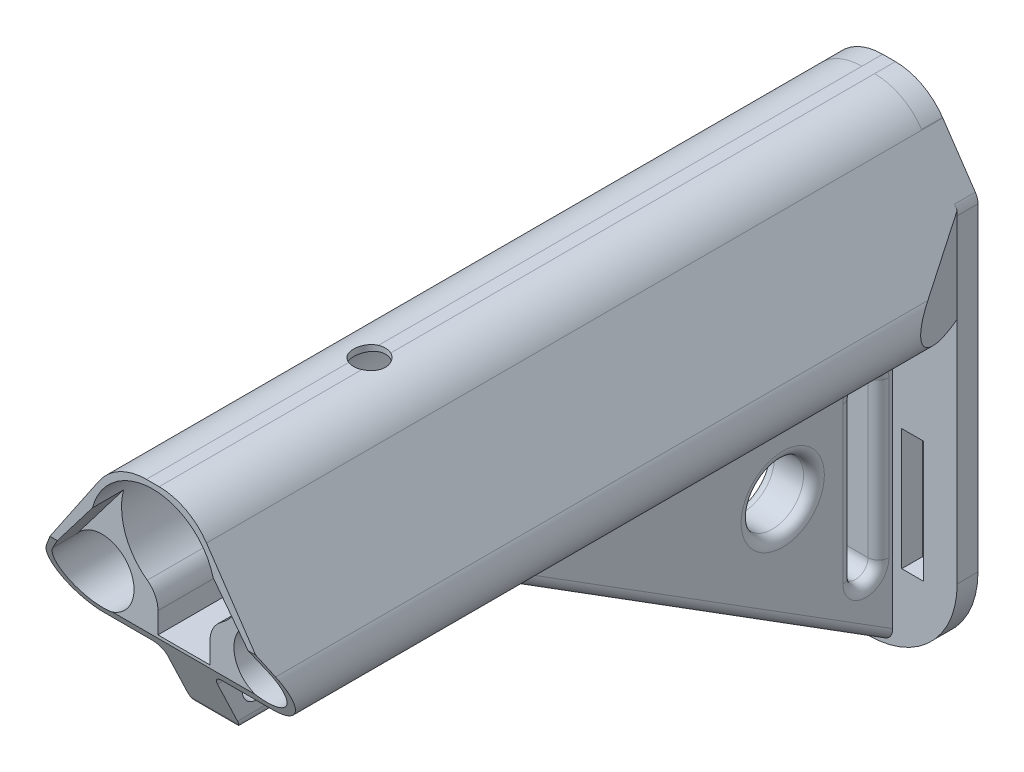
SolidWorks part; units mm, degrees
ref_plane "Front Plane" through (0, 0, 0) normal (0, 0, 1) x (1, 0, 0)
ref_plane "Top Plane" through (0, 0, 0) normal (0, 1, 0) x (1, 0, 0)
ref_plane "Right Plane" through (0, 0, 0) normal (1, 0, 0) x (0, 0, -1)
imported_body "Imported1"
imported_body "Imported2"
imported_body "Imported3"
sketch "Sketch2" plane through (0, -15.3594, 0) normal (0, -1, 0) x (1, 0, 0)
  circle A0 centre (-0.127, 121.6089) radius 3.8989
extrude "Cut-Extrude1" cut sketch "Sketch2" against normal blind 67.818
sketch "Sketch3" plane through (0, 0, -3.81) normal (0, 0, -1) x (-1, 0, 0)
  line L0 (21.717, 12.8644) -> (21.717, 14.3622) construction
  line L1 (21.717, 14.3622) -> (-21.717, 14.3622) construction
  line L2 (-21.717, 14.3622) -> (-21.717, 12.8644) construction
  line L3 (-21.717, 12.8644) -> (21.717, 12.8644) construction
  line L4 (21.717, 10.3244) -> (21.717, 11.8222) construction
  line L5 (21.717, 11.8222) -> (-21.717, 11.8222) construction
  line L6 (-21.717, 11.8222) -> (-21.717, 10.3244) construction
  line L7 (-21.717, 10.3244) -> (21.717, 10.3244) construction
  line L8 (21.717, 7.7844) -> (21.717, 9.2822) construction
  line L9 (21.717, 9.2822) -> (-21.717, 9.2822) construction
  line L10 (-21.717, 9.2822) -> (-21.717, 7.7844) construction
  line L11 (-21.717, 7.7844) -> (21.717, 7.7844) construction
  line L12 (-15.1656, 5.2444) -> (15.1656, 5.2444) construction
  line L13 (15.1656, 6.7422) -> (-15.1656, 6.7422) construction
  line L14 (-21.717, 6.7422) -> (-21.717, 5.2444) construction
  line L15 (-21.717, 5.2444) -> (-18.1084, 5.2444) construction
  line L16 (-18.1084, 6.7422) -> (-21.717, 6.7422) construction
  line L17 (21.717, 5.2444) -> (21.717, 6.7422) construction
  line L18 (21.717, 6.7422) -> (18.1084, 6.7422) construction
  line L19 (18.1084, 5.2444) -> (21.717, 5.2444) construction
  line L20 (21.717, 2.7044) -> (21.717, 4.2022) construction
  line L21 (21.717, 4.2022) -> (-21.717, 4.2022) construction
  line L22 (-21.717, 4.2022) -> (-21.717, 2.7044) construction
  line L23 (-21.717, 2.7044) -> (21.717, 2.7044) construction
  line L24 (21.717, 0.1644) -> (21.717, 1.6622) construction
  line L25 (21.717, 1.6622) -> (3.6437, 1.6622) construction
  line L26 (3.6437, 1.6622) -> (3.6437, 0.1644) construction
  line L27 (3.6437, 0.1644) -> (21.717, 0.1644) construction
  line L28 (-21.717, 1.6622) -> (-21.717, 0.1644) construction
  line L29 (-21.717, 0.1644) -> (-3.6437, 0.1644) construction
  line L30 (-3.6437, 0.1644) -> (-3.6437, 1.6622) construction
  line L31 (-3.6437, 1.6622) -> (-21.717, 1.6622) construction
  line L32 (21.717, -2.3756) -> (21.717, -0.8778) construction
  line L33 (21.717, -0.8778) -> (-21.717, -0.8778) construction
  line L34 (-21.717, -0.8778) -> (-21.717, -2.3756) construction
  line L35 (-21.717, -2.3756) -> (21.717, -2.3756) construction
  line L36 (21.717, -4.9156) -> (21.717, -3.4178) construction
  line L37 (21.717, -3.4178) -> (-21.717, -3.4178) construction
  line L38 (-21.717, -3.4178) -> (-21.717, -4.9156) construction
  line L39 (-21.717, -4.9156) -> (21.717, -4.9156) construction
  line L40 (21.717, -7.4556) -> (21.717, -5.9578) construction
  line L41 (21.717, -5.9578) -> (-21.717, -5.9578) construction
  line L42 (-21.717, -5.9578) -> (-21.717, -7.4556) construction
  line L43 (-21.717, -7.4556) -> (21.717, -7.4556) construction
  line L44 (21.717, -9.9956) -> (21.717, -8.4978) construction
  line L45 (21.717, -8.4978) -> (-21.717, -8.4978) construction
  line L46 (-21.717, -8.4978) -> (-21.717, -9.9956) construction
  line L47 (-21.717, -9.9956) -> (21.717, -9.9956) construction
  line L48 (21.717, -12.5356) -> (21.717, -11.0378) construction
  line L49 (21.717, -11.0378) -> (-21.717, -11.0378) construction
  line L50 (-21.717, -11.0378) -> (-21.717, -12.5356) construction
  line L51 (-21.717, -12.5356) -> (21.717, -12.5356) construction
  line L52 (21.717, -15.0756) -> (21.717, -13.5778) construction
  line L53 (21.717, -13.5778) -> (-21.717, -13.5778) construction
  line L54 (-21.717, -13.5778) -> (-21.717, -15.0756) construction
  line L55 (-21.717, -15.0756) -> (21.717, -15.0756) construction
  line L56 (21.717, -17.6156) -> (21.717, -16.1178) construction
  line L57 (21.717, -16.1178) -> (-21.717, -16.1178) construction
  line L58 (-21.717, -16.1178) -> (-21.717, -17.6156) construction
  line L59 (-21.717, -17.6156) -> (21.717, -17.6156) construction
  line L60 (21.717, -20.1556) -> (21.717, -18.6578) construction
  line L61 (21.717, -18.6578) -> (-21.717, -18.6578) construction
  line L62 (-21.717, -18.6578) -> (-21.717, -20.1556) construction
  line L63 (-21.717, -20.1556) -> (21.717, -20.1556) construction
  line L64 (21.717, -22.6956) -> (21.717, -21.1978) construction
  line L65 (21.717, -21.1978) -> (-21.717, -21.1978) construction
  line L66 (-21.717, -21.1978) -> (-21.717, -22.6956) construction
  line L67 (-21.717, -22.6956) -> (21.717, -22.6956) construction
  line L68 (21.717, -25.2356) -> (21.717, -23.7378) construction
  line L69 (21.717, -23.7378) -> (-21.717, -23.7378) construction
  line L70 (-21.717, -23.7378) -> (-21.717, -25.2356) construction
  line L71 (-21.717, -25.2356) -> (21.717, -25.2356) construction
  line L72 (21.717, -27.7756) -> (21.717, -26.2778) construction
  line L73 (21.717, -26.2778) -> (-21.717, -26.2778) construction
  line L74 (-21.717, -26.2778) -> (-21.717, -27.7756) construction
  line L75 (-21.717, -27.7756) -> (21.717, -27.7756) construction
  line L76 (21.717, 12.8644) -> (21.717, 14.3622)
  line L77 (21.717, 14.3622) -> (-21.717, 14.3622)
  line L78 (-21.717, 14.3622) -> (-21.717, 12.8644)
  line L79 (-21.717, 12.8644) -> (21.717, 12.8644)
  line L80 (21.717, 10.3244) -> (21.717, 11.8222)
  line L81 (21.717, 11.8222) -> (-21.717, 11.8222)
  line L82 (-21.717, 11.8222) -> (-21.717, 10.3244)
  line L83 (-21.717, 10.3244) -> (21.717, 10.3244)
  line L84 (21.717, 7.7844) -> (21.717, 9.2822)
  line L85 (21.717, 9.2822) -> (-21.717, 9.2822)
  line L86 (-21.717, 9.2822) -> (-21.717, 7.7844)
  line L87 (-21.717, 7.7844) -> (21.717, 7.7844)
  line L88 (-15.1656, 5.2444) -> (15.1656, 5.2444)
  line L89 (15.1656, 6.7422) -> (-15.1656, 6.7422)
  line L90 (-21.717, 6.7422) -> (-21.717, 5.2444)
  line L91 (-21.717, 5.2444) -> (-18.1084, 5.2444)
  line L92 (-18.1084, 6.7422) -> (-21.717, 6.7422)
  line L93 (21.717, 5.2444) -> (21.717, 6.7422)
  line L94 (21.717, 6.7422) -> (18.1084, 6.7422)
  line L95 (18.1084, 5.2444) -> (21.717, 5.2444)
  line L96 (21.717, 2.7044) -> (21.717, 4.2022)
  line L97 (21.717, 4.2022) -> (-21.717, 4.2022)
  line L98 (-21.717, 4.2022) -> (-21.717, 2.7044)
  line L99 (-21.717, 2.7044) -> (21.717, 2.7044)
  line L100 (21.717, 0.1644) -> (21.717, 1.6622)
  line L101 (21.717, 1.6622) -> (3.6437, 1.6622)
  line L102 (3.6437, 1.6622) -> (3.6437, 0.1644)
  line L103 (3.6437, 0.1644) -> (21.717, 0.1644)
  line L104 (-21.717, 1.6622) -> (-21.717, 0.1644)
  line L105 (-21.717, 0.1644) -> (-3.6437, 0.1644)
  line L106 (-3.6437, 0.1644) -> (-3.6437, 1.6622)
  line L107 (-3.6437, 1.6622) -> (-21.717, 1.6622)
  line L108 (21.717, -2.3756) -> (21.717, -0.8778)
  line L109 (21.717, -0.8778) -> (-21.717, -0.8778)
  line L110 (-21.717, -0.8778) -> (-21.717, -2.3756)
  line L111 (-21.717, -2.3756) -> (21.717, -2.3756)
  line L112 (21.717, -4.9156) -> (21.717, -3.4178)
  line L113 (21.717, -3.4178) -> (-21.717, -3.4178)
  line L114 (-21.717, -3.4178) -> (-21.717, -4.9156)
  line L115 (-21.717, -4.9156) -> (21.717, -4.9156)
  line L116 (21.717, -7.4556) -> (21.717, -5.9578)
  line L117 (21.717, -5.9578) -> (-21.717, -5.9578)
  line L118 (-21.717, -5.9578) -> (-21.717, -7.4556)
  line L119 (-21.717, -7.4556) -> (21.717, -7.4556)
  line L120 (21.717, -9.9956) -> (21.717, -8.4978)
  line L121 (21.717, -8.4978) -> (-21.717, -8.4978)
  line L122 (-21.717, -8.4978) -> (-21.717, -9.9956)
  line L123 (-21.717, -9.9956) -> (21.717, -9.9956)
  line L124 (21.717, -12.5356) -> (21.717, -11.0378)
  line L125 (21.717, -11.0378) -> (-21.717, -11.0378)
  line L126 (-21.717, -11.0378) -> (-21.717, -12.5356)
  line L127 (-21.717, -12.5356) -> (21.717, -12.5356)
  line L128 (21.717, -15.0756) -> (21.717, -13.5778)
  line L129 (21.717, -13.5778) -> (-21.717, -13.5778)
  line L130 (-21.717, -13.5778) -> (-21.717, -15.0756)
  line L131 (-21.717, -15.0756) -> (21.717, -15.0756)
  line L132 (21.717, -17.6156) -> (21.717, -16.1178)
  line L133 (21.717, -16.1178) -> (-21.717, -16.1178)
  line L134 (-21.717, -16.1178) -> (-21.717, -17.6156)
  line L135 (-21.717, -17.6156) -> (21.717, -17.6156)
  line L136 (21.717, -20.1556) -> (21.717, -18.6578)
  line L137 (21.717, -18.6578) -> (-21.717, -18.6578)
  line L138 (-21.717, -18.6578) -> (-21.717, -20.1556)
  line L139 (-21.717, -20.1556) -> (21.717, -20.1556)
  line L140 (21.717, -22.6956) -> (21.717, -21.1978)
  line L141 (21.717, -21.1978) -> (-21.717, -21.1978)
  line L142 (-21.717, -21.1978) -> (-21.717, -22.6956)
  line L143 (-21.717, -22.6956) -> (21.717, -22.6956)
  line L144 (21.717, -25.2356) -> (21.717, -23.7378)
  line L145 (21.717, -23.7378) -> (-21.717, -23.7378)
  line L146 (-21.717, -23.7378) -> (-21.717, -25.2356)
  line L147 (-21.717, -25.2356) -> (21.717, -25.2356)
  line L148 (21.717, -27.7756) -> (21.717, -26.2778)
  line L149 (21.717, -26.2778) -> (-21.717, -26.2778)
  line L150 (-21.717, -26.2778) -> (-21.717, -27.7756)
  line L151 (-21.717, -27.7756) -> (21.717, -27.7756)
  arc A0 (-15.1656, 5.2444) -> (-15.1656, 6.7422) centre (-16.637, 5.9933) ccw construction
  arc A1 (15.1656, 6.7422) -> (15.1656, 5.2444) centre (16.637, 5.9933) ccw construction
  arc A2 (-18.1084, 6.7422) -> (-18.1084, 5.2444) centre (-16.637, 5.9933) ccw construction
  arc A3 (18.1084, 5.2444) -> (18.1084, 6.7422) centre (16.637, 5.9933) ccw construction
  arc A4 (-15.1656, 5.2444) -> (-15.1656, 6.7422) centre (-16.637, 5.9933) ccw
  arc A5 (15.1656, 6.7422) -> (15.1656, 5.2444) centre (16.637, 5.9933) ccw
  arc A6 (-18.1084, 6.7422) -> (-18.1084, 5.2444) centre (-16.637, 5.9933) ccw
  arc A7 (18.1084, 5.2444) -> (18.1084, 6.7422) centre (16.637, 5.9933) ccw
extrude "Boss-Extrude1" add sketch "Sketch3" along normal up to surface (1.27 mm away)
sketch "Sketch4" plane through (2.667, 0, 0) normal (1, 0, 0) x (0, 0, -1)
  line L0 (-61.7658, -4.6006) -> (-16.0458, -4.6006) construction
  line L1 (-16.0458, -10.8388) -> (-61.7658, -10.8388) construction
  line L2 (-61.7658, -4.6006) -> (-16.0458, -4.6006)
  line L3 (-16.0458, -10.8388) -> (-61.7658, -10.8388)
  line L7 (-79.8508, -22.9642) -> (-40.9975, -47.6314)
  line L8 (-40.9975, -47.6314) -> (-33.8465, -39.0453)
  line L9 (-21.5799, -24.3169) -> (-1.3271, 0.0002)
  line L10 (-1.3271, 0.0002) -> (-114.6004, 0.0142)
  line L11 (-114.6004, 0.0142) -> (-114.6004, -12.8194)
  line L12 (-114.6004, -12.8194) -> (-96.7621, -12.8194)
  line L13 (-96.7621, -12.8194) -> (-79.8508, -22.9642)
  line L14 (-79.8508, -22.9642) -> (-40.9975, -47.6314)
  line L15 (-40.9975, -47.6314) -> (-33.8465, -39.0453)
  line L16 (-21.5799, -24.3169) -> (-1.3271, 0.0002)
  line L17 (-1.3271, 0.0002) -> (-114.6004, 0.0142)
  line L18 (-114.6004, 0.0142) -> (-114.6004, -12.8194)
  line L19 (-114.6004, -12.8194) -> (-96.7621, -12.8194)
  line L20 (-96.7621, -12.8194) -> (-79.8508, -22.9642)
  arc A0 (-61.7658, -4.6006) -> (-61.7658, -10.8388) centre (-61.7658, -7.7197) ccw construction
  arc A1 (-21.5799, -24.3169) -> (-33.8465, -39.0453) centre (-26.833, -32.4142) ccw
  arc A2 (-21.5799, -24.3169) -> (-33.8465, -39.0453) centre (-26.833, -32.4142) ccw
  arc A3 (-16.0458, -10.8388) -> (-16.0458, -4.6006) centre (-16.0458, -7.7197) ccw construction
  arc A4 (-61.7658, -4.6006) -> (-61.7658, -10.8388) centre (-61.7658, -7.7197) ccw
  arc A5 (-16.0458, -10.8388) -> (-16.0458, -4.6006) centre (-16.0458, -7.7197) ccw
  dimension "D1" = 0
extrude "Boss-Extrude4" add sketch "Sketch4" along normal up to surface and the other way up to surface
sketch "Sketch5" plane through (-2.667, 0, 0) normal (-1, 0, 0) x (0, 0, 1)
  line L0 (3.4591, -57.7399) -> (3.4591, -19.6879) construction
  line L1 (3.4591, -57.7399) -> (3.4591, -19.6879)
  line L2 (9.6065, -19.6879) -> (9.6065, -57.7399) construction
  line L3 (9.6065, -19.6879) -> (9.6065, -57.7399)
  line L4 (0, -73.66) -> (38.8532, -48.9928)
  line L5 (38.8532, -48.9928) -> (31.9955, -40.5696)
  line L6 (19.8939, -25.7053) -> (0, -1.27)
  line L7 (0, -1.27) -> (0, -73.66)
  line L8 (0, -73.66) -> (38.8532, -48.9928)
  line L9 (38.8532, -48.9928) -> (31.9955, -40.5696)
  line L10 (19.8939, -25.7053) -> (0, -1.27)
  line L11 (0, -1.27) -> (0, -73.66)
  arc A0 (9.6065, -19.6879) -> (3.4591, -19.6879) centre (6.5328, -19.6879) ccw construction
  arc A1 (19.8939, -25.7053) -> (31.9955, -40.5696) centre (26.833, -32.4142) ccw
  arc A2 (19.8939, -25.7053) -> (31.9955, -40.5696) centre (26.833, -32.4142) ccw
  arc A3 (3.4591, -57.7399) -> (9.6065, -57.7399) centre (6.5328, -57.7399) ccw construction
  arc A4 (9.6065, -19.6879) -> (3.4591, -19.6879) centre (6.5328, -19.6879) ccw
  arc A5 (3.4591, -57.7399) -> (9.6065, -57.7399) centre (6.5328, -57.7399) ccw
  dimension "D1" = 0
extrude "Boss-Extrude5" add sketch "Sketch5" along normal up to surface and the other way up to surface
sketch "Sketch6" plane through (0, 0, -3.81) normal (0, 0, -1) x (-1, 0, 0)
  line L0 (21.1998, -60.5914) -> (-21.1998, -60.5914) construction
  line L1 (-20.8887, -61.8204) -> (20.8887, -61.8204) construction
  line L2 (20.3788, -63.3854) -> (-20.3788, -63.3854) construction
  line L3 (-19.8831, -64.6144) -> (19.8831, -64.6144) construction
  line L4 (19.1193, -66.1794) -> (-19.1193, -66.1794) construction
  line L5 (-18.4045, -67.4084) -> (18.4045, -67.4084) construction
  line L6 (21.1998, -60.5914) -> (-21.1998, -60.5914)
  line L7 (-20.8887, -61.8204) -> (20.8887, -61.8204)
  line L8 (20.3788, -63.3854) -> (-20.3788, -63.3854)
  line L9 (-19.8831, -64.6144) -> (19.8831, -64.6144)
  line L10 (19.1193, -66.1794) -> (-19.1193, -66.1794)
  line L11 (-18.4045, -67.4084) -> (18.4045, -67.4084)
  arc A0 (20.8887, -61.8204) -> (21.1998, -60.5914) centre (0, -55.88) ccw construction
  arc A1 (-21.1998, -60.5914) -> (-20.8887, -61.8204) centre (0, -55.88) ccw construction
  arc A2 (19.8831, -64.6144) -> (20.3788, -63.3854) centre (0, -55.88) ccw construction
  arc A3 (-20.3788, -63.3854) -> (-19.8831, -64.6144) centre (0, -55.88) ccw construction
  arc A4 (18.4045, -67.4084) -> (19.1193, -66.1794) centre (0, -55.88) ccw construction
  arc A5 (-19.1193, -66.1794) -> (-18.4045, -67.4084) centre (0, -55.88) ccw construction
  arc A6 (20.8887, -61.8204) -> (21.1998, -60.5914) centre (0, -55.88) ccw
  arc A7 (-21.1998, -60.5914) -> (-20.8887, -61.8204) centre (0, -55.88) ccw
  arc A8 (19.8831, -64.6144) -> (20.3788, -63.3854) centre (0, -55.88) ccw
  arc A9 (-20.3788, -63.3854) -> (-19.8831, -64.6144) centre (0, -55.88) ccw
  arc A10 (18.4045, -67.4084) -> (19.1193, -66.1794) centre (0, -55.88) ccw
  arc A11 (-19.1193, -66.1794) -> (-18.4045, -67.4084) centre (0, -55.88) ccw
extrude "Boss-Extrude6" add sketch "Sketch6" along normal up to surface (1.27 mm away)
sketch "Sketch7" plane through (0, -0.1194, 0) normal (0, -1, 0) x (1, 0, 0)
  line L0 (8.763, 147.5806) -> (5.969, 147.5806) construction
  line L1 (5.969, 147.5806) -> (5.969, 132.0031) construction
  line L2 (5.969, 132.0031) -> (8.763, 132.0031) construction
  line L3 (8.763, 132.0031) -> (8.763, 147.5806) construction
  line L4 (-6.223, 132.0031) -> (-6.223, 147.5806) construction
  line L5 (-6.223, 147.5806) -> (-9.017, 147.5806) construction
  line L6 (-9.017, 147.5806) -> (-9.017, 132.0031) construction
  line L7 (-9.017, 132.0031) -> (-6.223, 132.0031) construction
  line L8 (8.763, 147.5806) -> (5.969, 147.5806)
  line L9 (5.969, 147.5806) -> (5.969, 132.0031)
  line L10 (5.969, 132.0031) -> (8.763, 132.0031)
  line L11 (8.763, 132.0031) -> (8.763, 147.5806)
  line L12 (-6.223, 132.0031) -> (-6.223, 147.5806)
  line L13 (-6.223, 147.5806) -> (-9.017, 147.5806)
  line L14 (-9.017, 147.5806) -> (-9.017, 132.0031)
  line L15 (-9.017, 132.0031) -> (-6.223, 132.0031)
extrude "Cut-Extrude2" cut sketch "Sketch7" against normal up to surface (0.1357 mm away)
sketch "Sketch9" plane through (0, 2.6545, 0) normal (0, -1, 0) x (1, 0, 0)
  line L4 (-4.2631, 167.005) -> (-4.2631, 159.385)
  line L5 (-4.2631, 159.385) -> (4.2631, 159.385)
  line L6 (4.2631, 159.385) -> (4.2631, 167.005)
  line L7 (4.2631, 167.005) -> (-4.2631, 167.005)
  line L8 (-4.2631, 167.005) -> (-4.2631, 159.385)
  line L9 (-4.2631, 159.385) -> (4.2631, 159.385)
  line L10 (4.2631, 159.385) -> (4.2631, 167.005)
  line L11 (4.2631, 167.005) -> (-4.2631, 167.005)
  dimension "D1" = 0
extrude "Cut-Extrude3" cut sketch "Sketch9" against normal blind 8.763
sketch "Sketch10" plane through (0, 0, 159.385) normal (0, 0, 1) x (1, 0, 0)
  line L4 (4.2631, -12.9339) -> (4.2631, 2.8152)
  line L5 (4.2631, 2.8152) -> (-4.2631, 2.8152)
  line L6 (-4.2631, 2.8152) -> (-4.2631, -12.9339)
  line L7 (-4.2631, -12.9339) -> (4.2631, -12.9339)
  line L8 (4.2631, -12.9339) -> (4.2631, 2.8152)
  line L9 (4.2631, 2.8152) -> (-4.2631, 2.8152)
  line L10 (-4.2631, 2.8152) -> (-4.2631, -12.9339)
  line L11 (-4.2631, -12.9339) -> (4.2631, -12.9339)
  dimension "D1" = 0
extrude "Boss-Extrude7" add sketch "Sketch10" along normal up to surface (7.9625 mm away)
sketch "Sketch11" plane through (-4.2631, 0, 0) normal (-1, 0, 0) x (0, 0, 1)
  line L3 (167.005, 2.8152) -> (167.005, 2.096)
  line L4 (167.005, 2.096) -> (167.3475, 2.8152)
  line L5 (167.3475, 2.8152) -> (167.005, 2.8152)
  line L6 (167.005, 2.8152) -> (167.005, 2.096)
  line L7 (167.005, 2.096) -> (167.3475, 2.8152)
  line L8 (167.3475, 2.8152) -> (167.005, 2.8152)
  dimension "D1" = 0
extrude "Cut-Extrude4" cut sketch "Sketch11" against normal blind 8.763
sketch "Sketch12" plane through (-6.223, 0, 0) normal (-1, 0, 0) x (0, 0, 1)
  line L1 (147.5806, -15.3594) -> (96.7621, -15.3594) construction
  line L3 (114.7114, -13.4544) -> (128.6953, -13.4544)
  line L4 (114.7114, -13.4544) -> (114.7114, -15.3594)
  line L5 (114.7114, -15.3594) -> (128.6953, -15.3594)
  line L6 (128.6953, -13.4544) -> (128.6953, -15.3594)
extrude "Boss-Extrude8" add sketch "Sketch12" against normal up to surface (12.192 mm away)
sketch "Sketch13" plane through (0, -13.4544, 0) normal (0, 1, 0) x (1, 0, 0)
  circle A0 centre (-0.127, -121.6089) radius 2.6035
extrude "Cut-Extrude5" cut sketch "Sketch13" against normal blind 8.763
fillet "Fillet15" radius 2.54 8 edges at (-6.223, -38.7139, 3.4591) (-6.223, -16.6142, 6.5328) (-6.223, -38.7139, 9.6065) (-6.223, -60.8136, 6.5328) (5.969, -38.7139, 3.4591) (5.969, -60.8136, 6.5328) (5.969, -38.7139, 9.6065) (5.969, -16.6142, 6.5328)
sketch "Sketch14" plane through (0, 0, 147.5806) normal (0, 0, -1) x (-1, 0, 0)
  line L0 (6.223, -15.3594) -> (11.557, -15.3594) construction
  line L1 (11.557, -15.3594) -> (11.557, 0.0101) construction
  line L2 (11.557, 0.0101) -> (9.017, 0.0101) construction
  line L3 (9.017, 0.0101) -> (9.017, 0.0182) construction
  line L4 (9.017, 0.0182) -> (6.223, 0.0182) construction
  line L5 (6.223, 0.0182) -> (6.223, -15.3594) construction
  line L6 (-8.763, 0.0182) -> (-8.763, 0.0101) construction
  line L7 (-8.763, 0.0101) -> (-11.303, 0.0101) construction
  line L8 (-11.303, 0.0101) -> (-11.303, -15.3594) construction
  line L9 (-11.303, -15.3594) -> (-5.969, -15.3594) construction
  line L10 (-5.969, -15.3594) -> (-5.969, 0.0182) construction
  line L11 (-5.969, 0.0182) -> (-8.763, 0.0182) construction
  line L12 (6.223, -15.3594) -> (11.557, -15.3594)
  line L13 (11.557, -15.3594) -> (11.557, 0.0101)
  line L14 (11.557, 0.0101) -> (9.017, 0.0101)
  line L15 (9.017, 0.0101) -> (9.017, 0.0182)
  line L16 (9.017, 0.0182) -> (6.223, 0.0182)
  line L17 (6.223, 0.0182) -> (6.223, -15.3594)
  line L18 (-8.763, 0.0182) -> (-8.763, 0.0101)
  line L19 (-8.763, 0.0101) -> (-11.303, 0.0101)
  line L20 (-11.303, 0.0101) -> (-11.303, -15.3594)
  line L21 (-11.303, -15.3594) -> (-5.969, -15.3594)
  line L22 (-5.969, -15.3594) -> (-5.969, 0.0182)
  line L23 (-5.969, 0.0182) -> (-8.763, 0.0182)
extrude "Cut-Extrude6" cut sketch "Sketch14" against normal blind 32.639
fillet "Fillet16" radius 2.54 10 edges at (-6.223, -32.4142, 34.453) (5.969, -32.4142, 34.453) (5.969, -4.6006, 38.9058) (5.969, -7.7197, 12.9267) (5.969, -10.8388, 38.9058) (5.969, -7.7197, 64.8849) (-6.223, -4.6006, 38.9058) (-6.223, -7.7197, 64.8849) (-6.223, -10.8388, 38.9058) (-6.223, -7.7197, 12.9267)
fillet "Fillet17" radius 2.54 5 edges at (-6.223, -15.3594, 127.7275) (5.969, -15.3594, 127.7275) (-6.223, -45.7797, 48.3811) (5.969, -45.7797, 48.3811) (-0.127, -15.3594, 158.6929)
fillet "Fillet18" radius 6.35 1 edges at (-6.4479, 11.5912, 83.5025)
fillet "Fillet19" radius 6.35 1 edges at (6.4479, 11.5912, 83.5025)
sketch "Sketch16" plane through (0, 0, 174.625) normal (0, 0, 1) x (1, 0, 0)
  line L0 (17.6986, 25.4) -> (12.9265, 31.6503)
  line L2 (-17.8809, 25.1604) -> (-13.837, 30.4565)
  line L3 (-13.837, 30.4565) -> (-11.1508, 14.4317)
  line L4 (-11.1508, 14.4317) -> (-17.8809, 20.316)
  line L5 (-17.8809, 20.316) -> (-17.8809, 25.1604)
  line L6 (12.9265, 31.6503) -> (12.0229, 15.6482)
  line L7 (12.0229, 15.6482) -> (16.8914, 17.5994)
  line L8 (16.8914, 17.5994) -> (17.6986, 25.4)
extrude "Cut-Extrude7" cut sketch "Sketch16" against normal up to surface (7.62 mm away)
fillet "Fillet20" radius 2.54 5 edges at (5.969, 0.0092, 74.4539) (5.969, -0.1194, 0.7133) (5.969, -0.0596, 1.3769) (5.969, 0.0182, 156.7981) (5.969, -2.0606, 38.9058)
fillet "Fillet21" radius 2.54 5 edges at (-6.223, 0.0092, 74.4539) (-6.223, -0.1194, 0.7133) (-6.223, -0.0596, 1.3769) (-6.223, 0.0182, 156.7981) (-6.223, -2.0606, 38.9058)
sketch "Sketch23" plane through (0, 0, 15.367) normal (0, 0, 1) x (1, 0, 0)
  circle A0 centre (20.0152, 9.4742) radius 7.874
extrude "Boss-Extrude11" add sketch "Sketch23" against normal blind 15.748
sketch "Sketch24" plane through (0, 0, -0.381) normal (0, 0, -1) x (-1, 0, 0)
  line L1 (-21.717, 1.7863) -> (-21.717, 17.1621)
  line L2 (-21.717, 1.7863) -> (-21.717, 17.1621)
  arc A1 (-21.717, 17.1621) -> (-21.717, 1.7863) centre (-20.0152, 9.4742) ccw
  arc A2 (-21.717, 17.1621) -> (-21.717, 1.7863) centre (-20.0152, 9.4742) ccw
  dimension "D1" = 0
extrude "Cut-Extrude11" cut sketch "Sketch24" against normal up to surface (0.381 mm away)
sketch "Sketch25" plane through (0, 0, 15.367) normal (0, 0, 1) x (1, 0, 0)
  circle A0 centre (-20.0152, 9.4742) radius 8.128
extrude "Boss-Extrude12" add sketch "Sketch25" against normal blind 15.748
sketch "Sketch26" plane through (0, 0, -0.381) normal (0, 0, -1) x (-1, 0, 0)
  line L1 (21.717, 17.422) -> (21.717, 1.5264)
  line L2 (21.717, 17.422) -> (21.717, 1.5264)
  arc A1 (21.717, 1.5264) -> (21.717, 17.422) centre (20.0152, 9.4742) ccw
  arc A2 (21.717, 1.5264) -> (21.717, 17.422) centre (20.0152, 9.4742) ccw
  dimension "D1" = 0
extrude "Cut-Extrude12" cut sketch "Sketch26" against normal up to surface (0.381 mm away)
sketch "Sketch27" plane through (0, 0, -0.381) normal (0, 0, -1) x (-1, 0, 0)
  circle A0 centre (-16.637, 5.9933) radius 1.651 construction
  circle A1 centre (16.637, 5.9933) radius 1.651 construction
  circle A2 centre (-16.637, 5.9933) radius 1.651
  circle A3 centre (16.637, 5.9933) radius 1.651
extrude "Cut-Extrude13" cut sketch "Sketch27" against normal blind 0.508
sketch "Sketch28" plane through (0, 0, 0) normal (0, 0, -1) x (-1, 0, 0)
  line L4 (3.6437, 2.4086) -> (-3.6437, 2.4086)
  line L5 (-3.6437, 2.4086) -> (-3.6437, -0.582)
  line L6 (-3.6437, -0.582) -> (3.6437, -0.582)
  line L7 (3.6437, -0.582) -> (3.6437, 2.4086)
  line L8 (3.6437, 2.4086) -> (-3.6437, 2.4086)
  line L9 (-3.6437, 2.4086) -> (-3.6437, -0.582)
  line L10 (-3.6437, -0.582) -> (3.6437, -0.582)
  line L11 (3.6437, -0.582) -> (3.6437, 2.4086)
  dimension "D1" = 0
extrude "Cut-Extrude14" cut sketch "Sketch28" against normal blind 0.127
